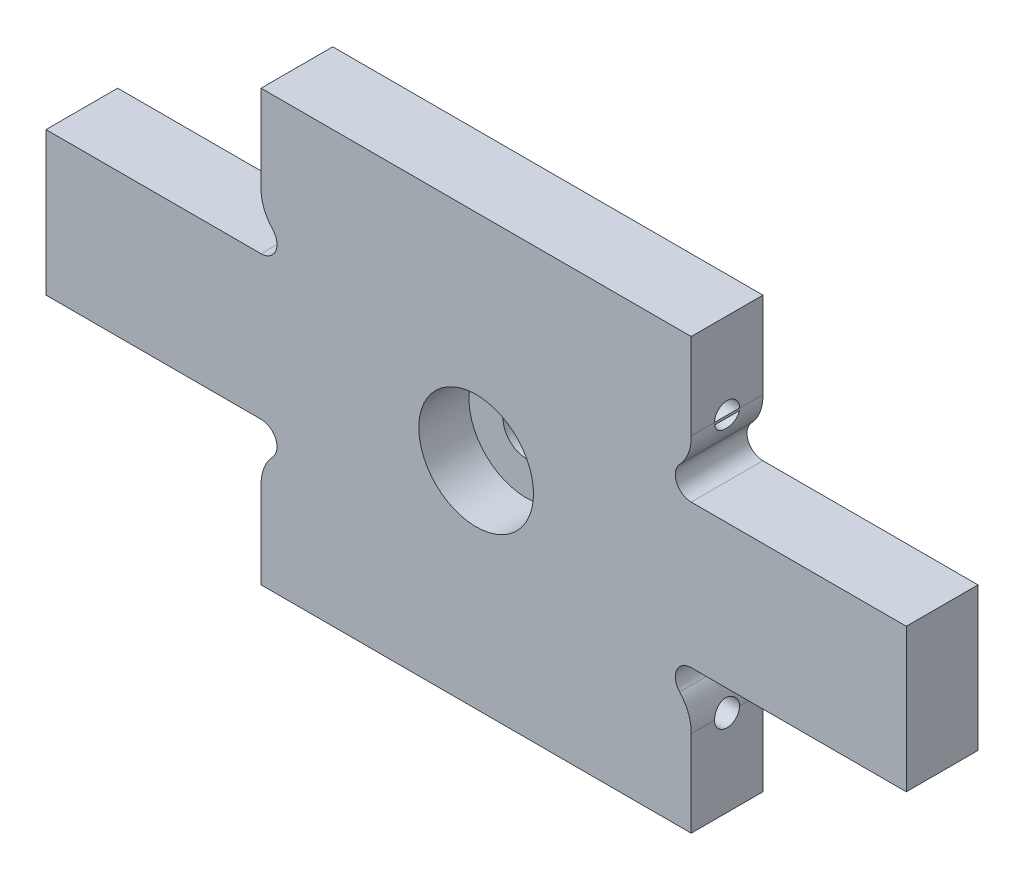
SolidWorks part; units mm, degrees
ref_plane "Plan de face" through (0, 0, 0) normal (0, 0, 1) x (1, 0, 0)
ref_plane "Plan de dessus" through (0, 0, 0) normal (0, 1, 0) x (1, 0, 0)
ref_plane "Plan de droite" through (0, 0, 0) normal (1, 0, 0) x (0, 0, -1)
sketch "Esquisse1" plane through (0, 0, 0) normal (0, 0, 1) x (1, 0, 0)
  line L6 (30, -10) -> (60, -10)
  line L7 (60, -10) -> (60, 10)
  line L8 (60, 10) -> (30, 10)
  line L10 (30, 30) -> (-30, 30)
  line L11 (-30, 30) -> (-30, 18)
  line L12 (-30, 10) -> (-60, 10)
  line L13 (-60, 10) -> (-60, -10)
  line L14 (-60, -10) -> (-30, -10)
  line L15 (-29.9978, -18) -> (-29.9978, -30)
  line L16 (-29.9978, -30) -> (29.9978, -30)
  line L17 (29.9978, -30) -> (29.9978, -18)
  line L18 (0, -55) -> (0, 55) construction
  line L19 (30, 30) -> (30, 18)
  arc A0 (29.9978, -18) -> (28.3796, -13.7374) centre (24, -17.8386) ccw
  arc A1 (30, -10) -> (28.3796, -13.7374) centre (30, -12.22) ccw
  arc A4 (-30, 18) -> (-28.3796, 13.7374) centre (-24.0021, 17.8408) ccw
  arc A5 (-30, 10) -> (-28.3796, 13.7374) centre (-30, 12.22) ccw
  arc A6 (-28.3796, -13.7374) -> (-30, -10) centre (-30, -12.22) ccw
  arc A7 (-28.3796, -13.7374) -> (-29.9978, -18) centre (-24, -17.8386) ccw
  arc A8 (30, 10) -> (28.3796, 13.7374) centre (30, 12.22) cw
  arc A9 (30, 18) -> (28.3796, 13.7374) centre (24.0021, 17.8408) cw
  dimension "D1" = 60
  dimension "D2" = 20
  dimension "D3" = 20
  dimension "D4" = 30
  dimension "D5" = 12
  dimension "D6" = 30
  dimension "D7" = 10
  dimension "D8" = 10
  dimension "D9" = 12
  dimension "D10" = 12
  dimension "D11" = 30
  dimension "D12" = 30
extrude "Boss.-Extru.1" add sketch "Esquisse1" along normal blind 10
sketch "Esquisse2" plane through (0, 0, 10) normal (0, 0, 1) x (1, 0, 0)
  circle A0 centre (0, 0) radius 3.25
  dimension "D1" = 6.5
extrude "Enlèv. mat.-Extru.1" cut sketch "Esquisse2" against normal blind 10
sketch "Esquisse3" plane through (0, 0, 10) normal (0, 0, 1) x (1, 0, 0)
  circle A0 centre (0, 0) radius 8
  dimension "D1" = 16
extrude "Enlèv. mat.-Extru.2" cut sketch "Esquisse3" against normal blind 7
hole_wizard "Diamètre du perçage Ø3.5 (3.5)1" positions "Esquisse4" profile "Esquisse5" hole size "Ø3.5" standard "ISO"
sketch "Esquisse4" plane through (-30, 0, 0) normal (-1, 0, 0) x (0, 0, 1)
  point P0 (5, 18)
  point P2 (5, -18)
  point P10 (-0.7737, 22.8685)
  dimension "D1" = 18
  dimension "D2" = 18
  dimension "D3" = 5
  dimension "D4" = 5
sketch "Esquisse5" plane through (-30, 18, 5) normal (0, 1, 0) x (0, 0, 1)
  line L0 (0, 0) -> (0, 15.0515)
  line L1 (0, 15.0515) -> (1.75, 14)
  line L2 (1.75, 14) -> (1.75, 0)
  line L5 (1.75, 0) -> (0, 0)
  line L10 (0, 15.0515) -> (-1.75, 14) construction
  line L11 (0, -6.35) -> (0, 107.95) construction
  dimension "Diamètre du perçage" = 3.5
  dimension "Profondeur du perçage" = 14
  dimension "Angle de pointe" = 118
mirror "Symétrie1" about plane through (0, 0, 0) normal (1, 0, 0) of "Diamètre du perçage Ø3.5 (3.5)1"
